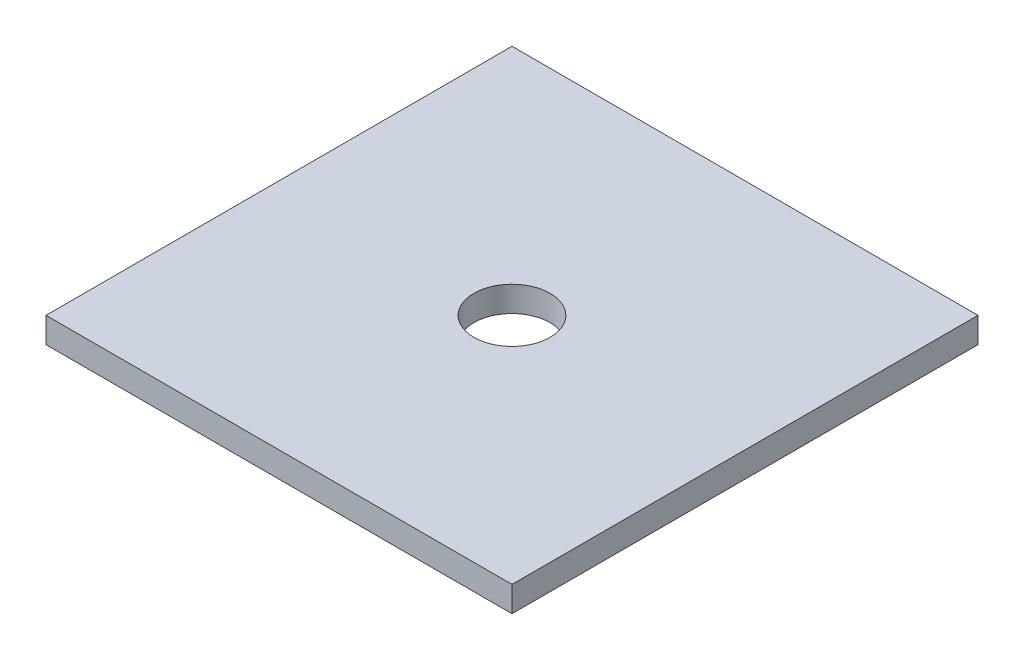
SolidWorks part; units mm, degrees
ref_plane "Front Plane" through (0, 0, 0) normal (0, 0, 1) x (1, 0, 0)
ref_plane "Top Plane" through (0, 0, 0) normal (0, 1, 0) x (1, 0, 0)
ref_plane "Right Plane" through (0, 0, 0) normal (1, 0, 0) x (0, 0, -1)
sketch "Sketch1" plane through (0, 0, 0) normal (0, 1, 0) x (1, 0, 0)
  line L0 (55, 55) -> (0, 0) construction
  line L1 (0, 0) -> (55, 0)
  line L2 (0, 0) -> (0, 55)
  line L3 (0, 55) -> (55, 55)
  line L4 (55, 0) -> (55, 55)
  circle A0 centre (27.5, 27.5) radius 4.5
  dimension "D3" = 9
  dimension "D1" = 55
  dimension "D2" = 55
extrude "Extrude1" add sketch "Sketch1" along normal blind 3
